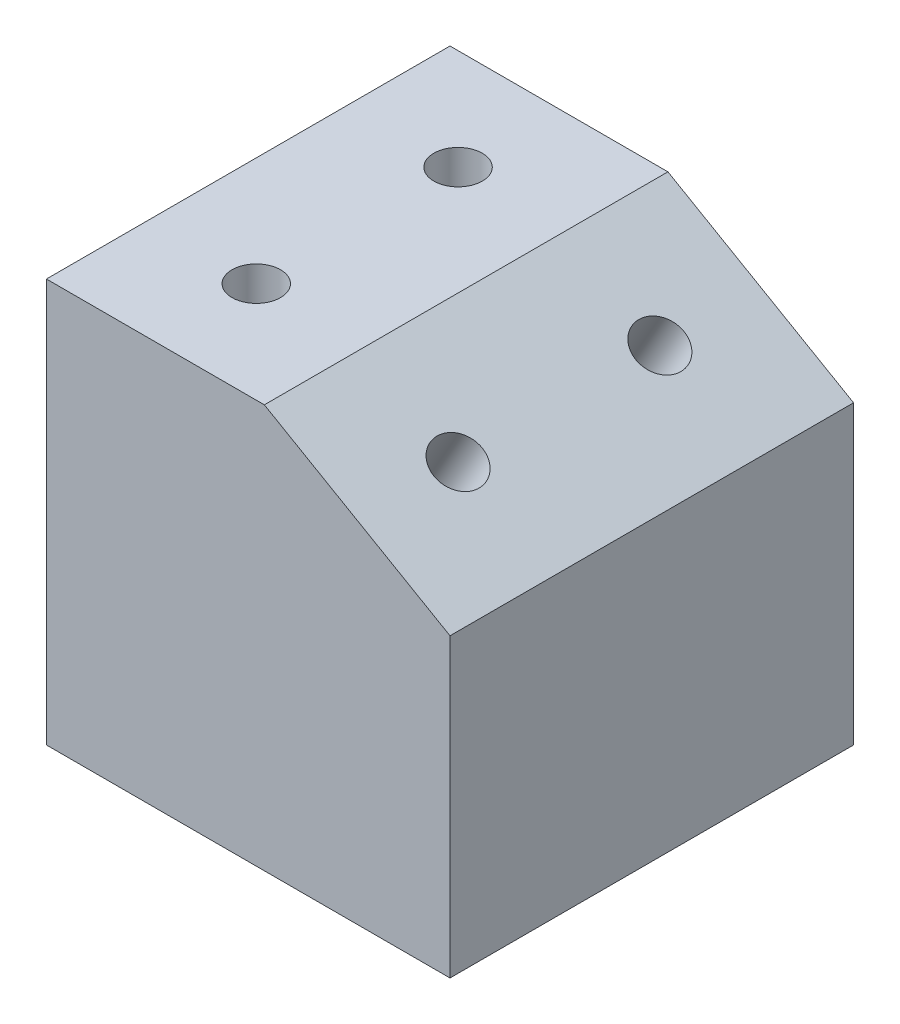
SolidWorks part; units mm, degrees
ref_plane "Ebene vorne" through (0, 0, 0) normal (0, 0, 1) x (1, 0, 0)
ref_plane "Ebene oben" through (0, 0, 0) normal (0, 1, 0) x (1, 0, 0)
ref_plane "Ebene rechts" through (0, 0, 0) normal (1, 0, 0) x (0, 0, -1)
sketch "Skizze1" plane through (0, 0, 0) normal (0, 0, 1) x (1, 0, 0)
  line L0 (2, 25) -> (25, 11.7209)
  line L1 (-25, -25) -> (25, -25)
  line L2 (-25, -25) -> (-25, 25)
  line L3 (-25, 25) -> (2, 25)
  line L4 (25, -25) -> (25, 11.7209)
  line L5 (-25, -25) -> (25, 25) construction
  line L6 (-25, 25) -> (25, -25) construction
  point P0 (0, 0)
  dimension "D1" = 50
  dimension "D2" = 50
  dimension "D3" = 30
  dimension "D4" = 27
extrude "Aufsatz-Linear austragen1" add sketch "Skizze1" along normal blind 50
sketch "Bohrpositionen oben" plane through (0, 25, 0) normal (0, 1, 0) x (1, 0, 0)
  line L0 (-11.5, 2.6119) -> (-11.5, -52.6839) construction
  line L1 (-28.4759, -37.5) -> (-2.196, -37.5) construction
  line L2 (-28.4759, -12.5) -> (-0.9, -12.5) construction
  line L3 (-0.9, -25) -> (-27.5674, -25) construction
  line L6 (-25, -50) -> (-25, 0) construction
  line L7 (2, -50) -> (2, 0) construction
  line L8 (2, 0) -> (-25, 0) construction
  line L9 (2, -50) -> (-25, -50) construction
  point P16 (-11.5, -12.5)
  point P17 (-11.5, -37.5)
  dimension "D1" = 25
sketch "Bohrpositionen seitlich" plane through (-25, 0, 0) normal (-1, 0, 0) x (0, 0, 1)
  line L0 (12.5, 27.2519) -> (12.5, -26.8199) construction
  line L1 (-2.6119, -5) -> (52.6839, -5) construction
  line L2 (37.5, 27.2519) -> (37.5, -26.8199) construction
  line L3 (50, -25) -> (0, -25) construction
  line L7 (5, -15) -> (45, -15) construction
  line L8 (5, -15) -> (5, 5) construction
  line L9 (5, 5) -> (45, 5) construction
  line L10 (45, -15) -> (45, 5) construction
  point P8 (12.5, -5)
  point P9 (37.5, -5)
  dimension "D1" = 20
  dimension "D2" = 20
  dimension "D3" = 7.5
  dimension "D4" = 7.5
sketch "Bohrpositionen Schräge" plane through (11.3253, 19.616, 0) normal (0.5, 0.866, 0) x (0.866, -0.5, 0)
  line L0 (-6.2244, -12.5) -> (14.2611, -12.5) construction
  line L1 (-6.2244, -37.5) -> (14.2611, -37.5) construction
  line L2 (2.5111, -4.1016) -> (2.5111, -45.4807) construction
  line L3 (-10.7679, -50) -> (-10.7679, 0) construction
  line L4 (15.7902, -50) -> (15.7902, 0) construction
  point P12 (2.5111, -12.5)
  point P13 (2.5111, -37.5)
hole_wizard "Ø6.0 (6) Durchmesser Bohrung2" positions "Skizze6" profile "Skizze5" hole size "Ø6.0" standard "DIN"
sketch "Skizze6" plane through (0, 25, 0) normal (0, 1, 0) x (-1, 0, 0)
  point P0 (11.5, 37.5)
  point P4 (11.5, 12.5)
sketch "Skizze5" plane through (-11.5, 25, 37.5) normal (1, 0, 0) x (0, 0, 1)
  line L0 (0, 0) -> (0, 31.8026)
  line L1 (0, 31.8026) -> (3, 30)
  line L2 (3, 30) -> (3, 0)
  line L5 (3, 0) -> (0, 0)
  line L10 (0, 31.8026) -> (-3, 30) construction
  line L11 (0, -6.35) -> (0, 107.95) construction
  dimension "Bohrerdurchmesser" = 6
  dimension "Bohrungstiefe" = 30
  dimension "Spitzenwinkel" = 118
sketch "Tiefe Bohrung Schräge und seitlich" plane through (0, 0, 50) normal (0, 0, 1) x (1, 0, 0)
  line L0 (-27.6275, -5) -> (13.8736, -5) construction
  line L1 (18.587, 27.1714) -> (8.3169, 9.3831) construction
  line L2 (5.9348, 22.7282) -> (23.6758, 12.4855) construction
  point P5 (0.0128, -5)
  point P9 (8.0128, -5)
  dimension "D1" = 8
hole_wizard "Ø6.0 (6) Durchmesser Bohrung1" positions "Skizze9" profile "Skizze8" hole size "Ø6.0" standard "DIN"
sketch "Skizze9" plane through (11.3253, 19.616, 0) normal (0.5, 0.866, 0) x (-0.866, 0.5, 0)
  point P1 (-2.5111, 12.5)
  point P4 (-2.5111, 37.5)
sketch "Skizze8" plane through (13.5, 18.3605, 12.5) normal (0, 0, 1) x (-0.866, 0.5, 0)
  line L0 (0, 0) -> (0, 28.7769)
  line L1 (0, 28.7769) -> (3, 26.9743)
  line L2 (3, 26.9743) -> (3, 0)
  line L5 (3, 0) -> (0, 0)
  line L10 (0, 28.7769) -> (-3, 26.9743) construction
  line L11 (0, -6.35) -> (0, 107.95) construction
  dimension "Bohrerdurchmesser" = 6
  dimension "Bohrungstiefe" = 26.9743
  dimension "Spitzenwinkel" = 118
hole_wizard "Stirnsenkung für M1.6 Flachkopfschraube mit Schlitz1" positions "Skizze11" profile "Skizze10" counterbore size "M1.6" standard "DIN"
sketch "Skizze11" plane through (-25, 0, 0) normal (-1, 0, 0) x (0, 0, 1)
  point P1 (37.5, -5)
  point P4 (12.5, -5)
sketch "Skizze10" plane through (-25, -5, 37.5) normal (0, 1, 0) x (0, 0, 1)
  line L0 (0, 0) -> (0, 35.4163)
  line L1 (0, 35.4163) -> (4, 33.0128)
  line L2 (4, 33.0128) -> (4, 1.2)
  line L3 (4, 1.2) -> (6, 1.2)
  line L4 (6, 1.2) -> (6, 0)
  line L5 (6, 0) -> (0, 0)
  line L10 (0, 35.4163) -> (-4, 33.0128) construction
  line L11 (0, -6.35) -> (0, 107.95) construction
  dimension "Bohrerdurchmesser" = 8
  dimension "Bohrungstiefe" = 33.0128
  dimension "Senkdurchmesser2" = 12
  dimension "Senktiefe2" = 1.2
  dimension "Spitzenwinkel" = 118
hole_wizard "M10x1.0 Gewindebohrung1" positions "Skizze13" profile "Skizze12" tap size "M10x1.0" standard "DIN"
sketch "Skizze13" plane through (0, 25, 0) normal (0, 1, 0) x (-1, 0, 0)
  point P0 (11.5, 37.5)
  point P4 (11.5, 12.5)
sketch "Skizze12" plane through (-11.5, 25, 37.5) normal (1, 0, 0) x (0, 0, 1)
  line L0 (0, 0) -> (0, 17.7039)
  line L1 (0, 17.7039) -> (4.5, 15)
  line L2 (4.5, 15) -> (4.5, 0)
  line L5 (4.5, 0) -> (0, 0)
  line L10 (0, 17.7039) -> (-4.5, 15) construction
  line L11 (0, -6.35) -> (0, 107.95) construction
  dimension "Bohrerdurchmesser" = 9
  dimension "Bohrungstiefe" = 15
  dimension "Spitzenwinkel" = 118
hole_wizard "M10x1.0 Gewindebohrung2" positions "Skizze15" profile "Skizze14" tap size "M10x1.0" standard "DIN"
sketch "Skizze15" plane through (11.3253, 19.616, 0) normal (0.5, 0.866, 0) x (-0.866, 0.5, 0)
  point P1 (-2.5111, 37.5)
  point P4 (-2.5111, 12.5)
sketch "Skizze14" plane through (13.5, 18.3605, 37.5) normal (0, 0, 1) x (-0.866, 0.5, 0)
  line L0 (0, 0) -> (0, 17.7039)
  line L1 (0, 17.7039) -> (4.5, 15)
  line L2 (4.5, 15) -> (4.5, 0)
  line L5 (4.5, 0) -> (0, 0)
  line L10 (0, 17.7039) -> (-4.5, 15) construction
  line L11 (0, -6.35) -> (0, 107.95) construction
  dimension "Bohrerdurchmesser" = 9
  dimension "Bohrungstiefe" = 15
  dimension "Spitzenwinkel" = 118
hole_wizard "M8 Gewindebohrung1" positions "Skizze17" profile "Skizze16" tap size "M8" standard "DIN"
sketch "Skizze17" plane through (-25, 0, 0) normal (-1, 0, 0) x (0, 0, 1)
  point P1 (5, 5)
  point P4 (45, 5)
  point P7 (5, -15)
  point P10 (45, -15)
sketch "Skizze16" plane through (-25, 5, 5) normal (0, 1, 0) x (0, 0, 1)
  line L0 (0, 0) -> (0, 18.0429)
  line L1 (0, 18.0429) -> (3.4, 16)
  line L2 (3.4, 16) -> (3.4, 0)
  line L5 (3.4, 0) -> (0, 0)
  line L10 (0, 18.0429) -> (-3.4, 16) construction
  line L11 (0, -6.35) -> (0, 107.95) construction
  dimension "Bohrerdurchmesser" = 6.8
  dimension "Bohrungstiefe" = 16
  dimension "Spitzenwinkel" = 118
equation "\"D4@Bohrpositionen seitlich\" = \"D3@Bohrpositionen seitlich\""
